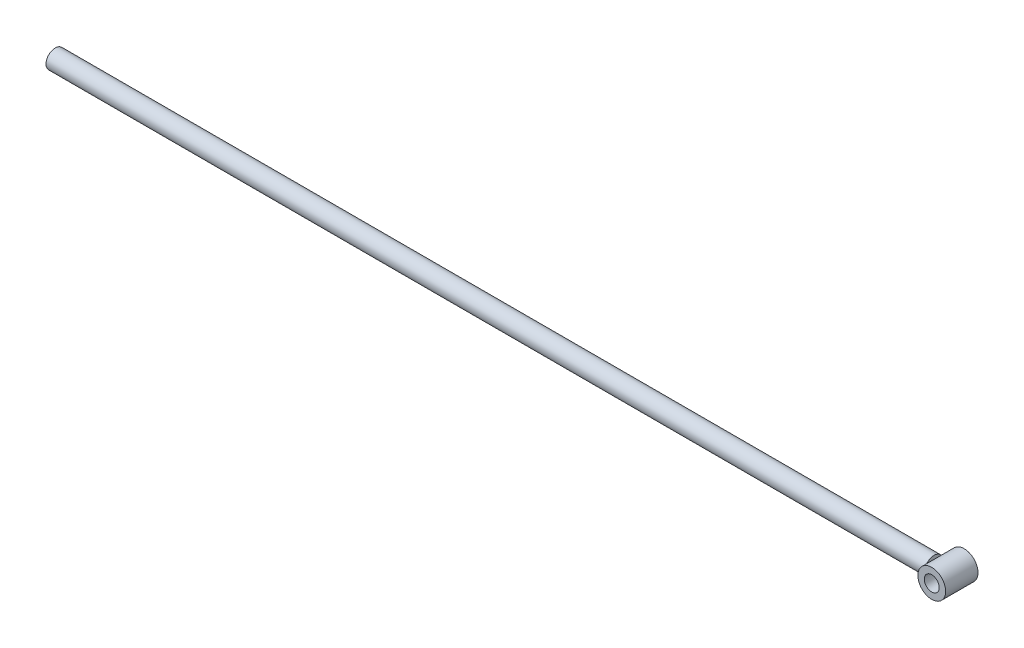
SolidWorks part; units mm, degrees
ref_plane "Plan de face" through (0, 0, 0) normal (0, 0, 1) x (1, 0, 0)
ref_plane "Plan de dessus" through (0, 0, 0) normal (0, 1, 0) x (1, 0, 0)
ref_plane "Plan de droite" through (0, 0, 0) normal (1, 0, 0) x (0, 0, -1)
sketch "Esquisse1" plane through (0, 0, 0) normal (1, 0, 0) x (0, 0, -1)
  circle A0 centre (0, 0) radius 10
  dimension "D1" = 20
extrude "Extrusion1" add sketch "Esquisse1" along normal blind 950
sketch "Esquisse2" plane through (0, 0, 0) normal (0, 0, 1) x (1, 0, 0)
  line L0 (950, -10) -> (950, 10) construction
  circle A0 centre (965, 0) radius 15
  circle A1 centre (965, 0) radius 8.1
  dimension "D1" = 16.2
  dimension "D2" = 30
extrude "Extrusion2" add sketch "Esquisse2" along normal mid plane 35
ref_plane "Plan1" through (937, 0, 0) normal (1, 0, 0) x (0, 0, -1)
